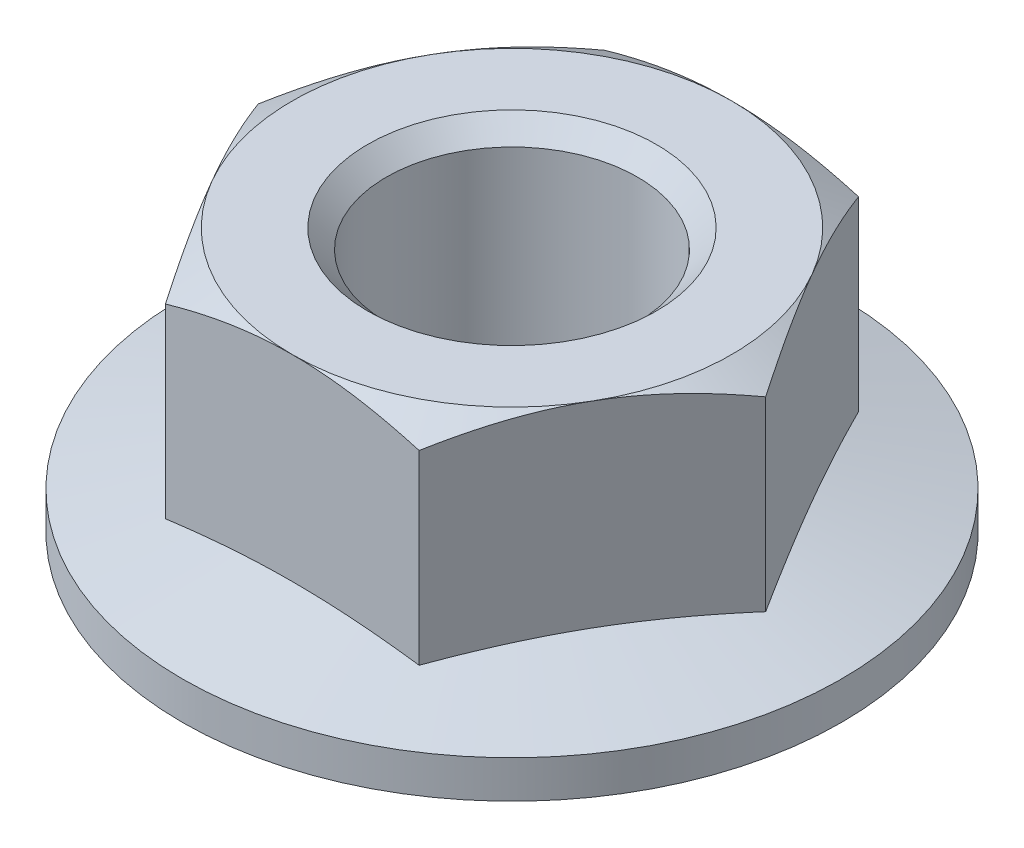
SolidWorks part; units mm, degrees
ref_plane "Front Plane" through (0, 0, 0) normal (0, 0, 1) x (1, 0, 0)
ref_plane "Top Plane" through (0, 0, 0) normal (0, 1, 0) x (1, 0, 0)
ref_plane "Right Plane" through (0, 0, 0) normal (1, 0, 0) x (0, 0, -1)
sketch "Sketch1" plane through (0, 0, 0) normal (0, 0, 1) x (1, 0, 0)
  line L8 (0, -2.1) -> (4.0415, -2.1) construction
  line L9 (4.0415, -2.1) -> (2.0207, 1.4) construction
  line L10 (2.0207, 1.4) -> (-2.0207, 1.4) construction
  line L11 (-2.0207, 1.4) -> (-4.0415, -2.1) construction
  line L12 (-4.0415, -2.1) -> (-2.0207, -5.6) construction
  line L13 (-2.0207, -5.6) -> (2.0207, -5.6) construction
  line L14 (2.0207, -5.6) -> (4.0415, -2.1) construction
  line L15 (2, 1.8) -> (2, -1.8)
  line L16 (2, -1.8) -> (2.3, -2.1)
  line L19 (4.0415, -1.1762) -> (4.0415, 1.7874)
  line L20 (4.0415, 1.7874) -> (3.5, 2.1)
  line L21 (3.5, 2.1) -> (2.3, 2.1)
  line L22 (2.3, 2.1) -> (2, 1.8)
  line L23 (2.3, 2.1) -> (2.3, -2.1) construction
  line L24 (3.5, 2.1) -> (3.5, -2.1) construction
  line L25 (0, 1.4) -> (0, -5.6) construction
  line L26 (2, 0) -> (0, 0) construction
  line L27 (2.3, -2.1) -> (5.25, -2.1)
  line L28 (5.25, -2.1) -> (5.25, -1.5)
  line L29 (5.25, -1.5) -> (4.0415, -1.1762)
  circle A0 centre (0, -2.1) radius 3.5 construction
  circle A1 centre (0, -2.1) radius 2 construction
  dimension "D2" = 15
  dimension "TAP" = 4
  dimension "D3" = 30
  dimension "D4" = 0.3
  dimension "SPANNER SIZE" = 7
  dimension "THK" = 4.2
  dimension "FLANGE WASHER THK" = 0.6
  dimension "FLANGE WASHER SIZE" = 10.5
  dimension "D7" = 0.3
revolve "Nut" add sketch "Sketch1" angle 360 about L25
sketch "Sketch3" plane through (0, 2.1, 0) normal (0, 1, 0) x (1, 0, 0)
  line L1 (4.0415, 0) -> (2.0207, 3.5)
  line L2 (2.0207, 3.5) -> (-2.0207, 3.5)
  line L3 (-2.0207, 3.5) -> (-4.0415, 0)
  line L4 (-4.0415, 0) -> (-2.0207, -3.5)
  line L5 (-2.0207, -3.5) -> (2.0207, -3.5)
  line L6 (2.0207, -3.5) -> (4.0415, 0)
  circle A0 centre (0, 0) radius 6.0415
  circle A1 centre (0, 0) radius 3.5 construction
  circle A3 centre (0, 0) radius 4.0415 construction
  dimension "D1" = 2
extrude "Cut-Extrude1" cut sketch "Sketch3" against normal up to surface (3.8121 mm away)
scale "Scale1" scale about centroid uniform scaling yes scale factor 1.2
